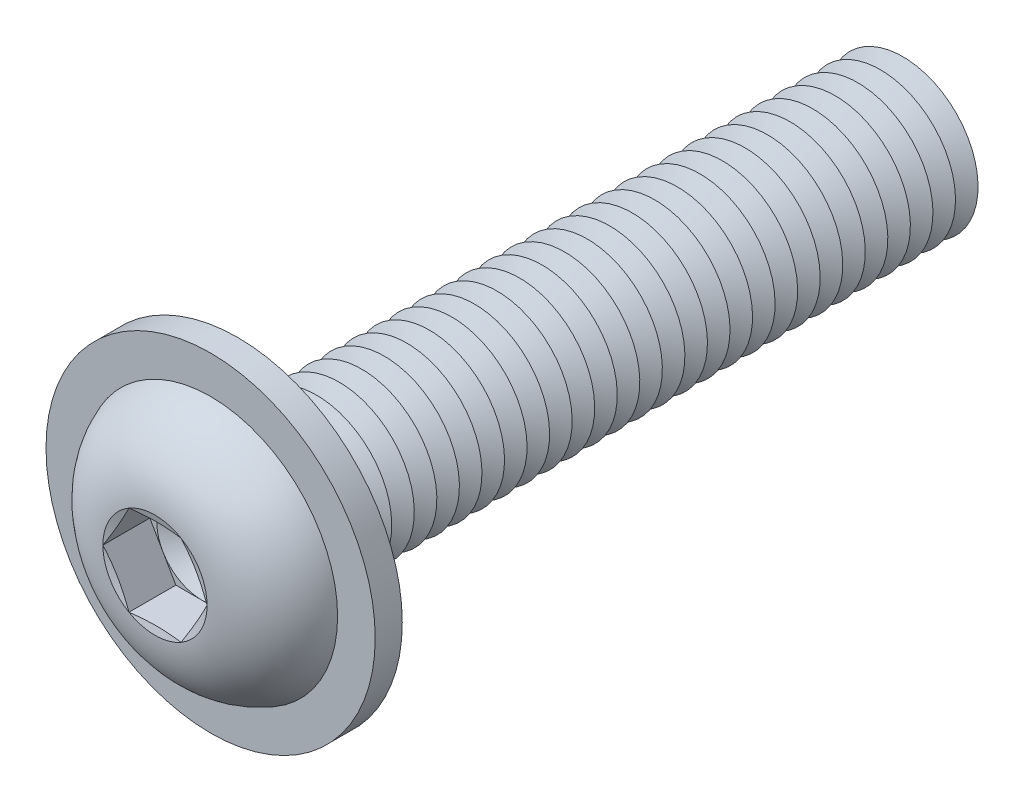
SolidWorks part; units mm, degrees
ref_plane "Front Plane" through (0, 0, 0) normal (0, 0, 1) x (1, 0, 0)
ref_plane "Top Plane" through (0, 0, 0) normal (0, 1, 0) x (1, 0, 0)
ref_plane "Right Plane" through (0, 0, 0) normal (1, 0, 0) x (0, 0, -1)
sketch "Sketch1" plane through (0, 0, 0) normal (1, 0, 0) x (0, 0, -1)
  line L0 (0, 5) -> (0, 8.75)
  line L3 (0, 5) -> (45, 5)
  line L4 (45, 5) -> (45, 0)
  line L5 (45, 0) -> (-5.5, 0) construction
  line L6 (-5.5, 0) -> (45, 0)
  line L7 (-5.5, 3.4641) -> (-5.5, 1.732) construction
  line L8 (-5.5, 1.732) -> (-5.5, 0)
  line L9 (-5.5, 3.4641) -> (-5.0359, 1.732)
  line L10 (-5.0359, 1.732) -> (-5.5, 1.732)
  line L11 (45, 0) -> (22.7481, 0) construction
  line L12 (0, 8.75) -> (-5.5, 8.75) construction
  arc A1 (0, 8.75) -> (-5.5, 3.4641) centre (0, 3.2457) ccw
  point P8 (45, 2.5)
  dimension "D1" = 17.5
  dimension "D2" = 10
  dimension "D3" = 5.5
  dimension "D4" = 6.9282
  dimension "D5" = 45
  dimension "D6" = 15
revolve "Revolve1" add sketch "Sketch1" angle 360 about L5
fillet "Fillet1" radius 0.75 1 edges at (0, 5, 0)
sketch "Sketch2" plane through (0, 0, 0) normal (1, 0, 0) x (0, 0, -1)
  line L0 (44.25, 5) -> (45.75, 5)
  line L1 (45, 5) -> (0.75, 5) construction
  line L2 (45.75, 5) -> (45, 3.701)
  line L3 (45, -5) -> (45, 5) construction
  line L4 (45, 3.701) -> (44.25, 5)
  dimension "D1" = 1.5
revolve "Cut-Revolve1" cut sketch "Sketch2" angle 360 about axis through (0, 0, -45) along (0, 0, -1)
pattern_linear "LPattern1" count 30 spacing 1.5 along (0, 0, 1) of "Cut-Revolve1"
sketch "Sketch3" plane through (0, 0, 5.5) normal (0, 0, 1) x (1, 0, 0)
  line L7 (1.732, 3) -> (-1.7321, 3)
  line L8 (-1.7321, 3) -> (-3.4641, 0)
  line L9 (-3.4641, 0) -> (-1.732, -3)
  line L10 (-1.732, -3) -> (1.732, -3)
  line L11 (1.732, -3) -> (3.4641, 0)
  line L12 (3.4641, 0) -> (1.732, 3)
  circle A0 centre (0, 0) radius 3 construction
  circle A3 centre (0, 0) radius 3.4641 construction
extrude "Cut-Extrude1" cut sketch "Sketch3" against normal blind 3.12
sketch "Sketch4" plane through (0, 0, 2.38) normal (0, 0, 1) x (1, 0, 0)
  line L1 (1.732, 3) -> (-1.7321, 3) construction
  circle A0 centre (0, 0) radius 3
extrude "Cut-Extrude2" cut sketch "Sketch4" against normal through all draft 60
sketch "Sketch5" plane through (0, 0, 0) normal (0, 0, -1) x (-1, 0, 0)
  circle A0 centre (0, 0) radius 10.95
  circle A1 centre (0, 0) radius 5.75
  circle A2 centre (0, 0) radius 5.75 construction
  dimension "D1" = 21.9
extrude "Boss-Extrude1" add sketch "Sketch5" against normal blind 1.8
